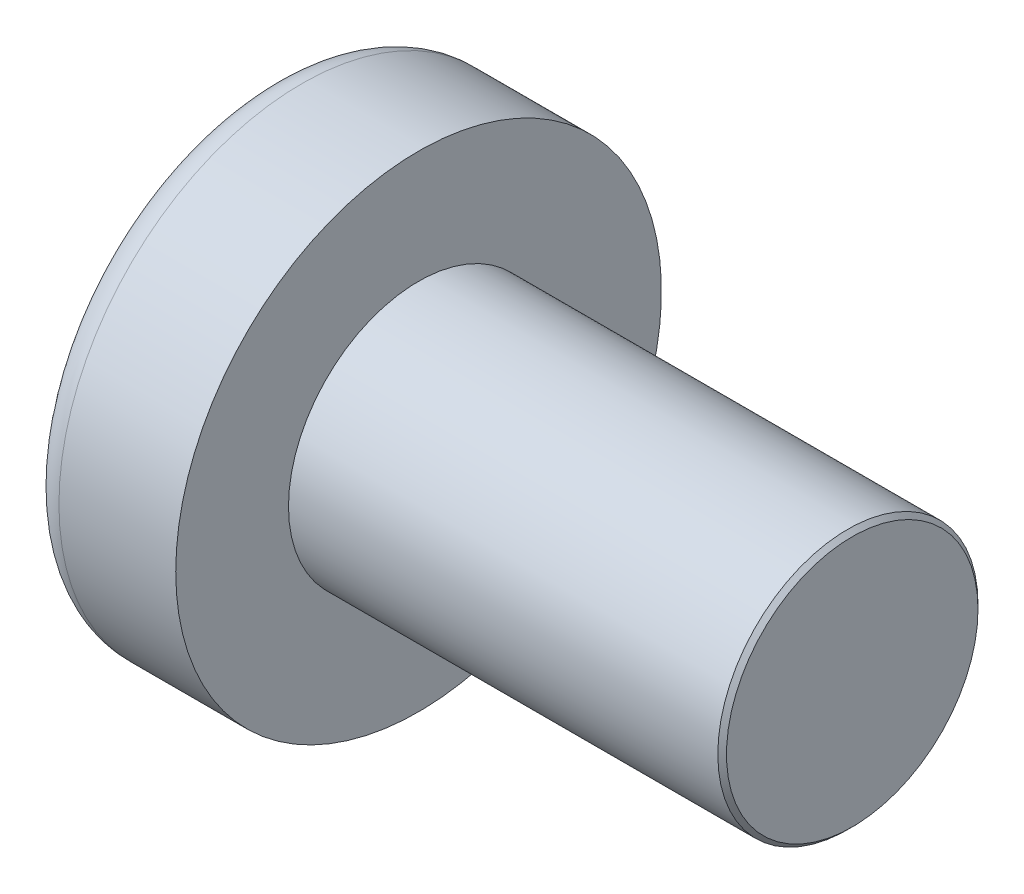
SolidWorks part; units mm, degrees
ref_plane "Plane1" through (0, 0, 0) normal (0, 0, 1) x (1, 0, 0)
ref_plane "Plane2" through (0, 0, 0) normal (0, 1, 0) x (1, 0, 0)
ref_plane "Plane3" through (0, 0, 0) normal (1, 0, 0) x (0, 0, -1)
sketch "BodySke" plane through (0, 0, 0) normal (0, 0, 1) x (1, 0, 0)
  line L0 (2.4, 1.5) -> (2.4, 2.8)
  line L1 (2.9, 6.35) -> (2.9, -3.175) construction
  line L2 (-25.4, 0) -> (127, 0) construction
  line L3 (7.4, 0) -> (0, 0)
  line L4 (2.4, 1.5) -> (7.4, 1.5)
  line L5 (7.4, 1.5) -> (7.4, 0)
  line L6 (1.0534, 2.8) -> (2.4, 2.8)
  line L7 (2.4, -1.5) -> (7.4, -1.5) construction
  line L8 (-0.6, 6.35) -> (-0.6, -3.175) construction
  arc A0 (0.7472, 2.6293) -> (0, 0) centre (5, 0) ccw
  arc A2 (0.7472, 2.6293) -> (1.0534, 2.8) centre (1.0534, 2.44) cw
  dimension "Head_fillet_rad" = 0.36
  dimension "Head_crown_rad" = 5
  dimension "Head_ht" = 2.4
  dimension "Diameter" = 3
  dimension "Length" = 5
  dimension "Head_dia" = 5.6
  dimension "Advance" = 0.5
  dimension "Thread_nom" = 8
revolve "Base-Revolve" add sketch "BodySke" angle 360 about L2
sketch "Sketch3" plane through (0, 0, 0) normal (1, 0, 0) x (0, 0, -1)
  line L0 (0.37, -1.45) -> (-0.37, -1.45)
  line L1 (0.37, -1.45) -> (0.37, 1.45)
  line L2 (-0.37, 1.45) -> (0.37, 1.45)
  line L3 (-0.37, 1.45) -> (-0.37, -1.45)
  dimension "D1" = 1.45
  dimension "Cross_dia" = 2.9
  dimension "D2" = 0.37
  dimension "Cross_width" = 0.74
ref_plane "Plane4" through (1.76, 0, 0) normal (1, 0, 0) x (0, 0, -1)
sketch "Sketch4" plane through (1.76, 0, 0) normal (1, 0, 0) x (0, 0, -1)
  line L0 (0.185, -0.185) -> (-0.185, -0.185)
  line L1 (0.185, -0.185) -> (0.185, 0.185)
  line L2 (-0.185, 0.185) -> (0.185, 0.185)
  line L3 (-0.185, 0.185) -> (-0.185, -0.185)
  dimension "D1" = 0.37
  dimension "D2" = 0.37
  dimension "D3" = 0.185
  dimension "D4" = 0.185
loft "Cut-Loft1" cut profiles "Sketch3", "Sketch4"
pattern_circular "CirPattern1" count 2 every 90 about axis through (0, 0, 0) along (1, 0, 0) of "Cut-Loft1"
chamfer "Chamfer1" distance 0.05 angle 45 1 edges at (7.4, 0, 1.5)
equation "\"D1@Sketch3\" = \"Cross_dia@Sketch3\" / 2"
equation "\"D2@Sketch3\" = \"Cross_width@Sketch3\" / 2"
equation "\"D1@Sketch4\" = \"Cross_width@Sketch3\" *.5"
equation "\"D2@Sketch4\" = \"D1@Sketch4\""
equation "\"D3@Sketch4\" = \"D1@Sketch4\" / 2"
equation "\"D4@Sketch4\" = \"D2@Sketch4\" / 2"
equation "\"Thread_length@ThreadCosmetic\" = ((sgn( (\"Length@BodySke\" - \"Advance@BodySke\" ) - \"Thread_nom@BodySke\" )-1)*( (\"Length@BodySke\" - \"Advance@BodySke\" ) - \"Thread_nom@BodySke\" ))/-2+ \"Thread_nom@BodySke\""
